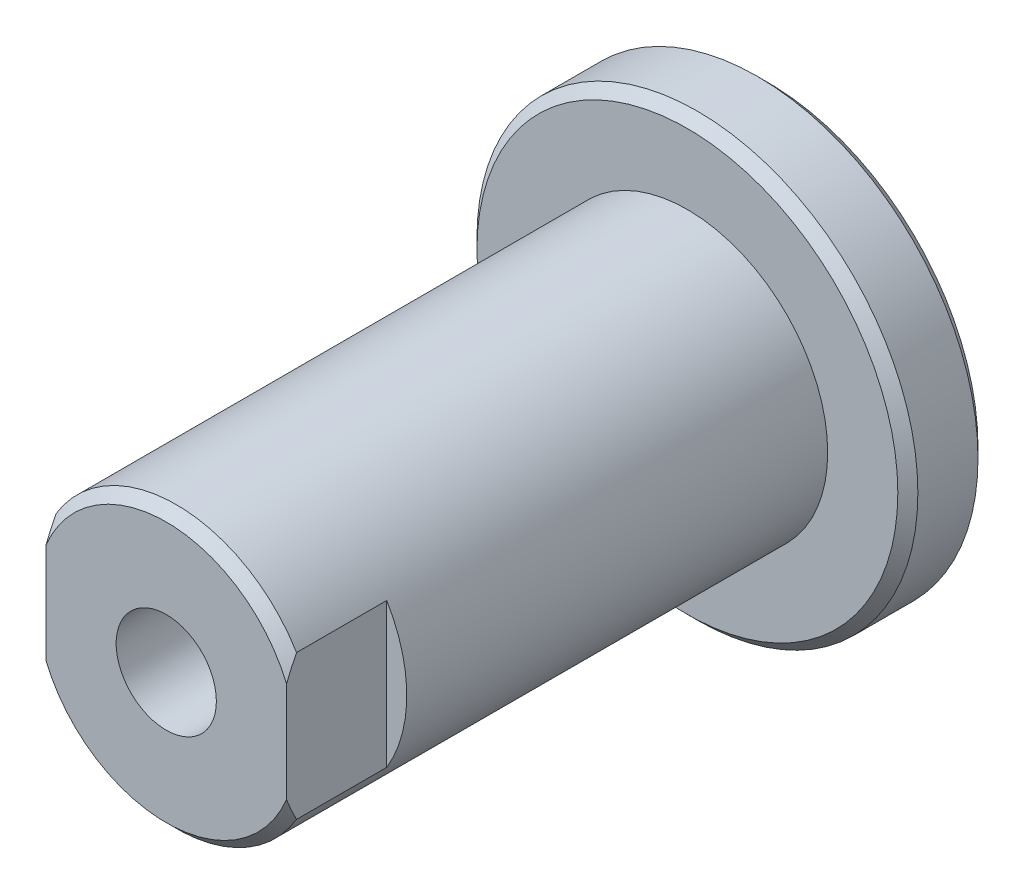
SolidWorks part; units mm, degrees
ref_plane "Face" through (0, 0, 0) normal (0, 0, 1) x (1, 0, 0)
ref_plane "Dessus" through (0, 0, 0) normal (0, 1, 0) x (1, 0, 0)
ref_plane "Droite" through (0, 0, 0) normal (1, 0, 0) x (0, 0, -1)
sketch "Esquisse1" plane through (0, 0, 0) normal (0, 0, 1) x (1, 0, 0)
  circle A0 centre (0, 0) radius 11
  dimension "D1" = 22
extrude "Extrusion1" add sketch "Esquisse1" along normal blind 4
sketch "Esquisse2" plane through (0, 0, 4) normal (0, 0, 1) x (1, 0, 0)
  circle A0 centre (0, 0) radius 7
  dimension "D1" = 14
extrude "Extrusion2" add sketch "Esquisse2" along normal blind 26
chamfer "Chanfrein2" distance 0.5 angle 45 3 edges at (7, 0, 30) (11, 0, 0) (11, 0, 4)
sketch "Esquisse3" plane through (0, 0, 30) normal (0, 0, 1) x (1, 0, 0)
  line L1 (6, 11.2334) -> (14.7084, 11.2334)
  line L2 (6, 11.2334) -> (6, -10.615)
  line L3 (6, -10.615) -> (14.7084, -10.615)
  line L4 (14.7084, 11.2334) -> (14.7084, -10.615)
  line L5 (-6, 13.8098) -> (-13.4717, 13.8098)
  line L6 (-6, 13.8098) -> (-6, -10.615)
  line L7 (-6, -10.615) -> (-13.4717, -10.615)
  line L8 (-13.4717, 13.8098) -> (-13.4717, -10.615)
  dimension "D1" = 12
  dimension "D2" = 6
extrude "Enlèv. mat.-Extru.1" cut sketch "Esquisse3" against normal blind 5
hole_wizard "Trou taraudé M61" positions "Esquisse5" profile "Esquisse4" tap size "M6" standard "ISO"
sketch "Esquisse5" plane through (0, 0, 30) normal (0, 0, 1) x (1, 0, 0)
  arc A0 (6, 2.5) -> (-6, 2.5) centre (0, 0) ccw construction
  point P0 (0, 0)
sketch "Esquisse4" plane through (0, 0, 30) normal (1, 0, 0) x (0, -1, 0)
  line L0 (0, 0) -> (0, 30)
  line L1 (0, 30) -> (2.5, 30)
  line L2 (2.5, 30) -> (2.5, 0)
  line L5 (2.5, 0) -> (0, 0)
  line L11 (0, -6.35) -> (0, 107.95) construction
  dimension "Diamètre du trou pour taraudage jusqu'au prochain" = 5
  dimension "Profondeur du trou pour taraudage jusqu'au prochain" = 30
